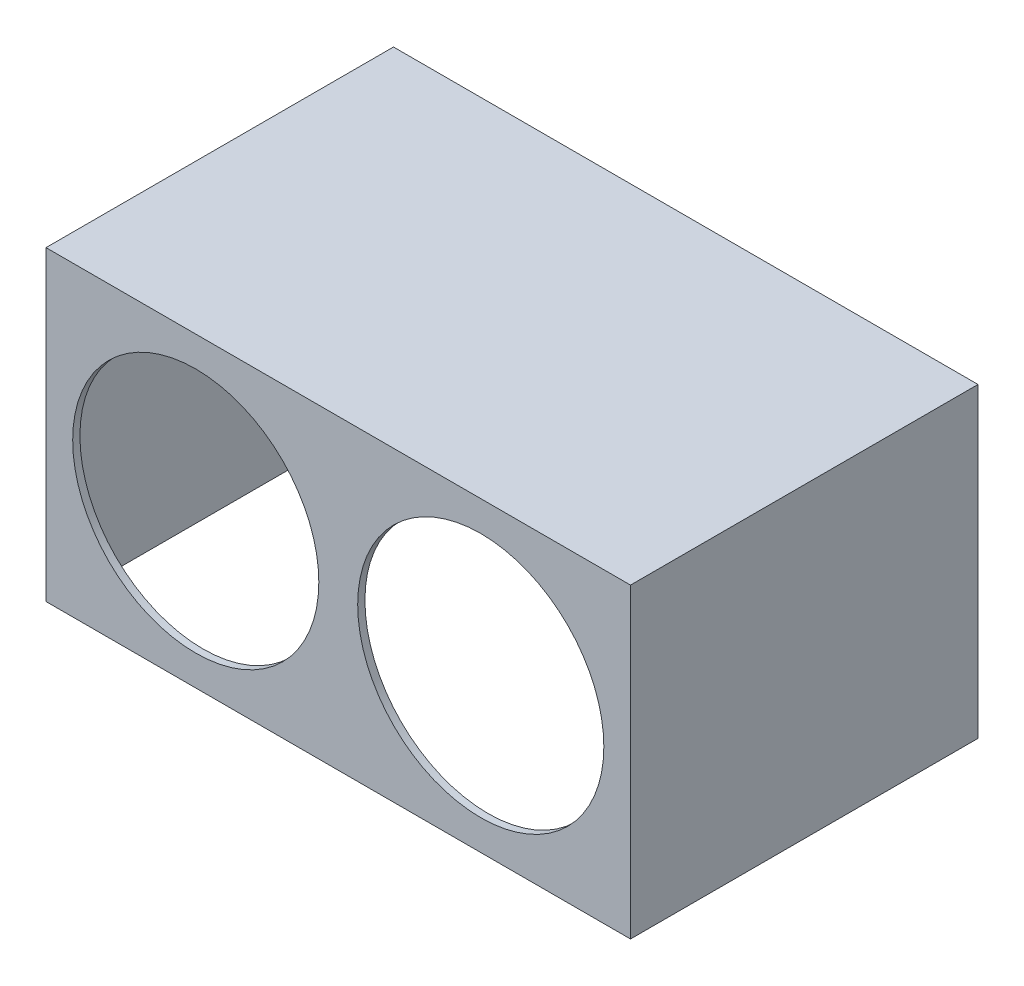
SolidWorks part; units mm, degrees
ref_plane "Front" through (0, 0, 0) normal (0, 0, 1) x (1, 0, 0)
ref_plane "Top" through (0, 0, 0) normal (0, 1, 0) x (1, 0, 0)
ref_plane "Right" through (0, 0, 0) normal (1, 0, 0) x (0, 0, -1)
sketch "Sketch1" plane through (0, 0, 0) normal (0, 0, 1) x (1, 0, 0)
  line L1 (512.699, 268.859) -> (-512.701, 268.859)
  line L2 (512.699, 268.859) -> (512.699, -268.859)
  line L3 (512.699, -268.859) -> (-512.701, -268.859)
  line L4 (-512.701, 268.859) -> (-512.701, -268.859)
  dimension "D1" = 537.718
  dimension "D2" = 1025.4
ref_plane "Plane1" through (0, 0, -609.6) normal (0, 0, 1) x (1, 0, 0)
sketch "Sketch2" plane through (0, 0, -609.6) normal (0, 0, 1) x (1, 0, 0)
  line L0 (512.699, -268.859) -> (-512.701, -268.859) construction
  line L1 (-512.701, 268.859) -> (512.699, 268.859)
  line L2 (-512.701, 268.859) -> (-512.701, -268.859)
  line L3 (-512.701, -268.859) -> (512.699, -268.859)
  line L4 (512.699, 268.859) -> (512.699, -268.859)
  line L5 (-512.701, 268.859) -> (-512.701, -268.859) construction
  dimension "D1" = 1025.4
  dimension "D2" = 537.718
ref_plane "Plane2" through (0, 0, -596.9) normal (0, 0, -1) x (-1, 0, 0)
loft "Loft2" add profiles "Sketch2", "Sketch1"
sketch "Sketch3" plane through (0, 0, 0) normal (0, 0, -1) x (-1, 0, 0)
  circle A0 centre (-250, 0) radius 215.9
  circle A1 centre (250, 0) radius 215.9
  point P0 (0, 0)
  dimension "D1" = 431.8
  dimension "D2" = 250
  dimension "D3" = 250
extrude "Cut-Extrude4" cut sketch "Sketch3" along normal through all
sketch "Sketch8" plane through (0, 0, -609.6) normal (0, 0, -1) x (-1, 0, 0)
  line L0 (512.701, 268.859) -> (512.701, -268.859) construction
  line L1 (-499.999, 256.159) -> (500.001, 256.159)
  line L2 (-499.999, 256.159) -> (-499.999, -256.159)
  line L3 (-499.999, -256.159) -> (500.001, -256.159)
  line L4 (500.001, 256.159) -> (500.001, -256.159)
  line L5 (-512.699, 268.859) -> (512.701, 268.859) construction
  line L6 (-512.699, -268.859) -> (512.701, -268.859) construction
  line L7 (-512.699, 268.859) -> (-512.699, -268.859) construction
  dimension "D1" = 12.7
  dimension "D2" = 12.7
  dimension "D3" = 12.7
  dimension "D4" = 12.7
extrude "Cut-Extrude5" cut sketch "Sketch8" against normal offset from surface (596.9 mm away) 12.7
sketch "Sketch10" plane through (0, -256.159, 0) normal (0, 1, 0) x (1, 0, 0)
  line L1 (499.999, 12.7) -> (-500.001, 12.7)
  line L2 (499.999, 12.7) -> (499.999, 678.4401)
  line L3 (499.999, 678.4401) -> (-500.001, 678.4401)
  line L4 (-500.001, 12.7) -> (-500.001, 678.4401)
extrude "Cut-Extrude6" cut sketch "Sketch10" against normal blind 50
